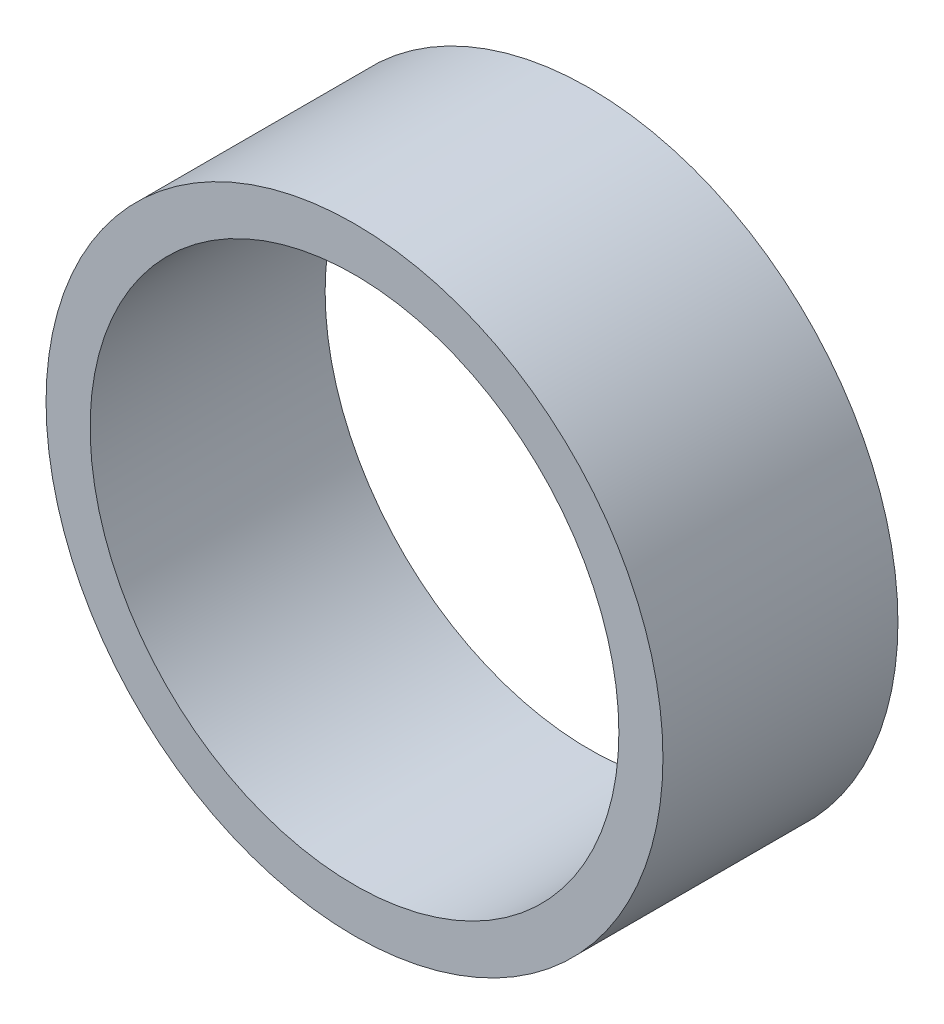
SolidWorks part; units mm, degrees
ref_plane "前视基准面" through (0, 0, 0) normal (0, 0, 1) x (1, 0, 0)
ref_plane "上视基准面" through (0, 0, 0) normal (0, 1, 0) x (1, 0, 0)
ref_plane "右视基准面" through (0, 0, 0) normal (1, 0, 0) x (0, 0, -1)
sketch "草图1" plane through (0, 0, 0) normal (0, 0, 1) x (1, 0, 0)
  circle A0 centre (4.5, 0) radius 10.5
  circle A1 centre (4.5, 0) radius 9
  circle A2 centre (4.5, 0) radius 10.5 construction
  circle A3 centre (4.5, 0) radius 9 construction
extrude "拉伸1" add sketch "草图1" against normal up to surface (8 mm away)
